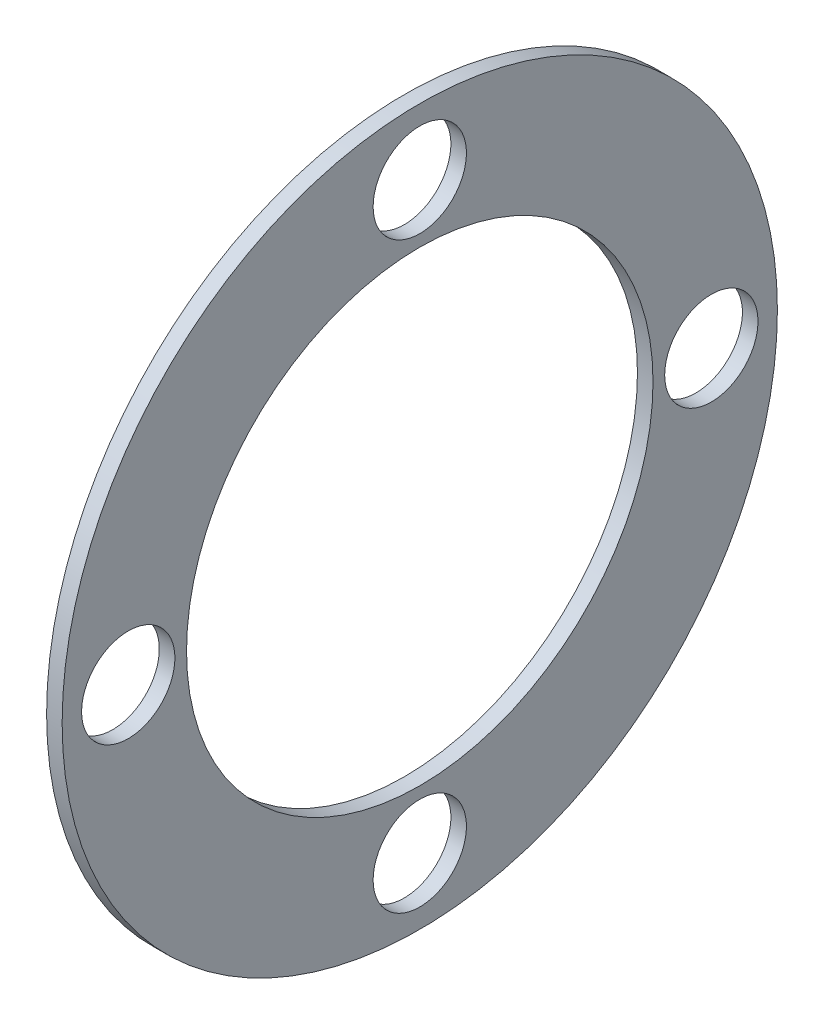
SolidWorks part; units mm, degrees
ref_plane "Спереди" through (0, 0, 0) normal (0, 0, 1) x (1, 0, 0)
ref_plane "Сверху" through (0, 0, 0) normal (0, 1, 0) x (1, 0, 0)
ref_plane "Справа" through (0, 0, 0) normal (1, 0, 0) x (0, 0, -1)
sketch "Sketch2" plane through (0, 0, 0) normal (0, 0, 1) x (1, 0, 0)
  line L0 (29.907, 0) -> (-13.6718, 0) construction
  line L1 (0, 0) -> (0, 46)
  line L2 (0, 46) -> (2, 46)
  line L3 (2, 46) -> (2, 0)
  line L6 (2, 0) -> (0, 0)
  dimension "D2" = 92
  dimension "D4" = 2
revolve "Revolve1" add sketch "Sketch2" angle 360 about L0
sketch "Sketch5" plane through (0, 0, 0) normal (-1, 0, 0) x (0, 0, 1)
  line L0 (0, 53.9829) -> (0, -55.9282) construction
  circle A0 centre (0, 0) radius 37.5 construction
  circle A1 centre (0, 37.5) radius 6
  circle A2 centre (37.5, 0) radius 6
  circle A3 centre (0, -37.5) radius 6
  circle A4 centre (-37.5, 0) radius 6
  dimension "D1" = 75
  dimension "D2" = 12
extrude "Cut-Extrude1" cut sketch "Sketch5" against normal up to next
sketch "Sketch6" plane through (0, 0, 0) normal (-1, 0, 0) x (0, 0, 1)
  circle A0 centre (0, 0) radius 30
  dimension "D1" = 60
extrude "Cut-Extrude2" cut sketch "Sketch6" against normal up to next
